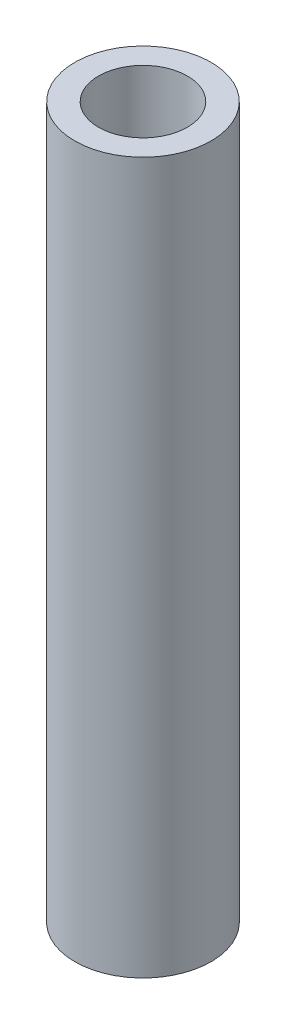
SolidWorks part; units mm, degrees
ref_plane "Front Plane" through (0, 0, 0) normal (0, 0, 1) x (1, 0, 0)
ref_plane "Top Plane" through (0, 0, 0) normal (0, 1, 0) x (1, 0, 0)
ref_plane "Right Plane" through (0, 0, 0) normal (1, 0, 0) x (0, 0, -1)
sketch "Sketch1" plane through (0, 0, 0) normal (0, 1, 0) x (1, 0, 0)
  circle A0 centre (0, 0) radius 1.875
  circle A1 centre (0, 0) radius 2.875
  dimension "D1" = 3.75
  dimension "D2" = 5.75
extrude "Boss-Extrude1" add sketch "Sketch1" along normal blind 30
